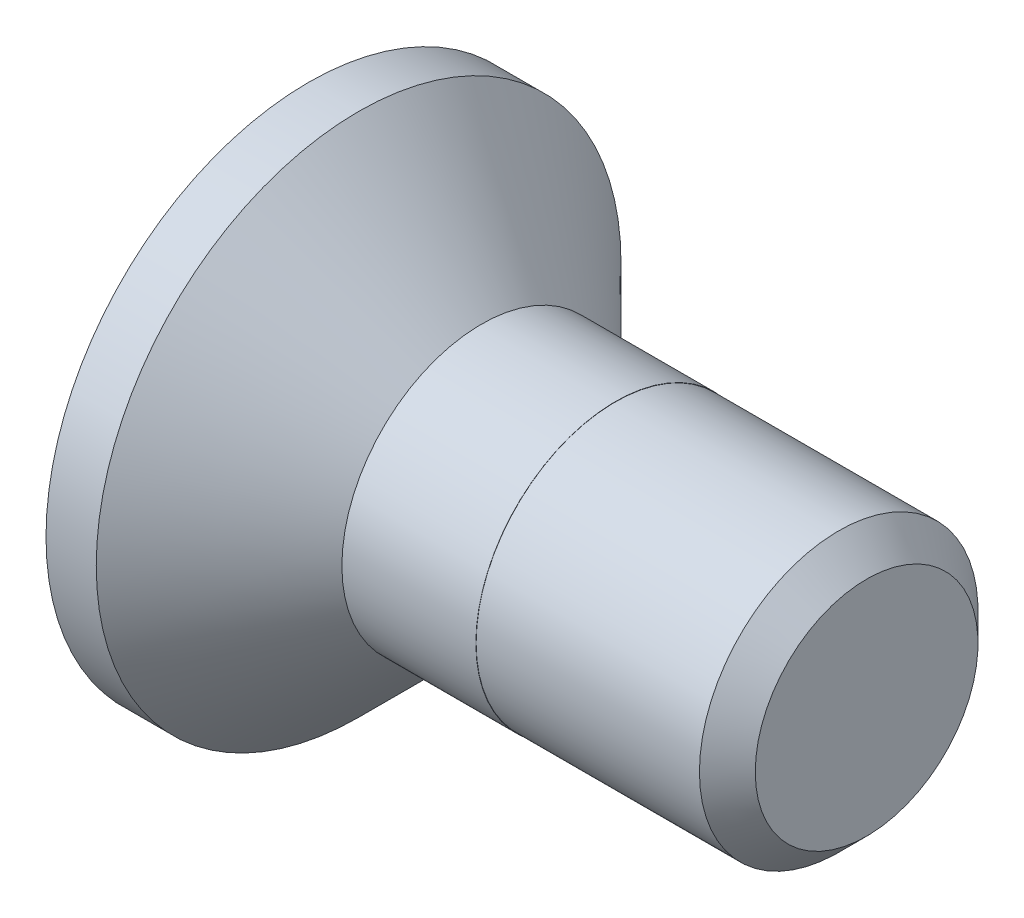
SolidWorks part; units mm, degrees
ref_plane "Ebene vorne" through (0, 0, 0) normal (0, 0, 1) x (1, 0, 0)
ref_plane "Ebene oben" through (0, 0, 0) normal (0, 1, 0) x (1, 0, 0)
ref_plane "Ebene rechts" through (0, 0, 0) normal (1, 0, 0) x (0, 0, -1)
sketch "Skizze1" plane through (0, 0, 0) normal (0, 0, 1) x (1, 0, 0)
  line L0 (0, 0) -> (50000, 0) construction
  line L1 (0, 2) -> (0, 4.7)
  line L2 (0, 4.7) -> (0.9, 4.7)
  line L3 (0.9, 4.7) -> (3.1, 2.5)
  line L4 (3.1, 2.5) -> (5.5, 2.5)
  line L5 (5.5, 2.5) -> (5.5, 2.495)
  line L6 (5.5, 2.495) -> (9.5, 2.495)
  line L7 (9.5, 2.495) -> (10, 1.995)
  line L8 (10, 1.995) -> (10, 0)
  line L9 (10, 0) -> (2.966, 0)
  line L10 (0, 2) -> (0.3, 1.5)
  line L11 (0.3, 1.5) -> (2.1, 1.5)
  line L12 (2.1, 1.5) -> (2.966, 0)
  dimension "D1" = 45
  dimension "D2" = 4.99
  dimension "Dk" = 9.4
  dimension "k" = 3.1
  dimension "l1" = 2.4
  dimension "D3" = 5
  dimension "D4" = 45
  dimension "D6" = 0.5
  dimension "D7" = 60
  dimension "SW" = 3
  dimension "D8" = 0.5
  dimension "D9" = 0.3
  dimension "K-1" = 2.1
  dimension "L" = 10
revolve "Rotation1" add sketch "Skizze1" angle 360 about L0
sketch "Skizze2" plane through (0, 0, 0) normal (-1, 0, 0) x (0, 0, 1)
  line L1 (1.7321, 0) -> (0.866, 1.5)
  line L2 (0.866, 1.5) -> (-0.866, 1.5)
  line L3 (-0.866, 1.5) -> (-1.7321, 0)
  line L4 (-1.7321, 0) -> (-0.866, -1.5)
  line L5 (-0.866, -1.5) -> (0.866, -1.5)
  line L6 (0.866, -1.5) -> (1.7321, 0)
  circle A0 centre (0, 0) radius 1.5 construction
  dimension "D1" = 3
extrude "Linear austragen1" cut sketch "Skizze2" against normal blind 2.1
